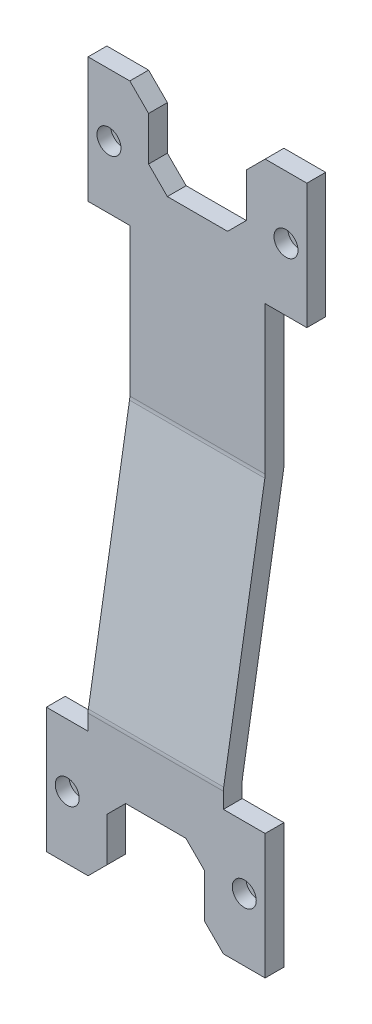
SolidWorks part; units mm, degrees
ref_plane "Alzado" through (0, 0, 0) normal (0, 0, 1) x (1, 0, 0)
ref_plane "Planta" through (0, 0, 0) normal (0, 1, 0) x (1, 0, 0)
ref_plane "Vista lateral" through (0, 0, 0) normal (1, 0, 0) x (0, 0, -1)
sketch "Croquis1" plane through (0, 0, 0) normal (0, 0, 1) x (1, 0, 0)
  line L18 (-16.2157, -79.99) -> (-16.2157, -64.99) construction
  line L19 (16.2157, -49.99) -> (16.2157, -64.99) construction
  line L20 (-16.2157, 49.99) -> (-16.2157, -49.99)
  line L21 (16.2157, -49.99) -> (16.2157, 49.99)
  line L22 (-7.2157, -60.49) -> (7.2157, -60.49)
  line L23 (16.2157, 79.99) -> (11.7157, 75.49)
  line L24 (11.7157, 75.49) -> (11.7157, 64.99)
  line L25 (11.7157, 64.99) -> (7.2157, 60.49)
  line L26 (-16.2157, 79.99) -> (-11.7157, 75.49)
  line L27 (-11.7157, 75.49) -> (-11.7157, 64.99)
  line L28 (-11.7157, 64.99) -> (-7.2157, 60.49)
  line L29 (-7.2157, 60.49) -> (7.2157, 60.49)
  line L34 (16.2157, -64.99) -> (16.2157, -79.99) construction
  line L35 (16.2157, -79.99) -> (26.2157, -79.99)
  line L36 (26.2157, -79.99) -> (26.2157, -49.99)
  line L37 (26.2157, -49.99) -> (16.2157, -49.99)
  line L38 (-26.2157, -49.99) -> (-26.2157, -79.99)
  line L39 (-26.2157, -79.99) -> (-16.2157, -79.99)
  line L40 (-16.2157, -64.99) -> (-16.2157, -49.99) construction
  line L41 (-16.2157, -49.99) -> (-26.2157, -49.99)
  line L42 (16.2157, 79.99) -> (16.2157, 49.99) construction
  line L43 (16.2157, 49.99) -> (26.2157, 49.99)
  line L44 (26.2157, 49.99) -> (26.2157, 79.99)
  line L45 (26.2157, 79.99) -> (16.2157, 79.99)
  line L46 (-26.2157, 79.99) -> (-26.2157, 49.99)
  line L47 (-26.2157, 49.99) -> (-16.2157, 49.99)
  line L48 (-16.2157, 49.99) -> (-16.2157, 79.99) construction
  line L49 (-16.2157, 79.99) -> (-26.2157, 79.99)
  line L50 (-16.2157, -79.99) -> (-11.7157, -75.49)
  line L51 (-11.7157, -75.49) -> (-11.7157, -64.99)
  line L52 (-11.7157, -64.99) -> (-7.2157, -60.49)
  line L53 (-16.2157, -64.99) -> (16.2157, -64.99) construction
  line L54 (0, 111.3599) -> (0, -111.3599) construction
  line L55 (16.2157, -79.99) -> (11.7157, -75.49)
  line L56 (11.7157, -75.49) -> (11.7157, -64.99)
  line L57 (11.7157, -64.99) -> (7.2157, -60.49)
  line L58 (-16.2157, 49.99) -> (-16.2157, -49.99) construction
  line L59 (-16.2157, 0) -> (0, 0) construction
  point P24 (0, -64.99)
  point P41 (0, 0)
  point P44 (0, 0)
  dimension "D1" = 10
  dimension "D2" = 30
  dimension "D3" = 4.5
  dimension "D4" = 10
  dimension "D5" = 45
  dimension "D6" = 23.4313
  dimension "D7" = 15
  dimension "D8" = 19.5
  dimension "D9" = 99.98
extrude "Saliente-Extruir1" add sketch "Croquis1" against normal blind 5
sketch "Croquis2" plane through (0, 0, -5) normal (0, 0, -1) x (-1, 0, 0)
  line L19 (-16.2157, -49.99) -> (16.2157, -49.99)
  line L50 (-16.2157, -49.99) -> (-26.2157, -49.99)
  line L51 (-26.2157, -49.99) -> (-26.2157, -79.99)
  line L52 (-26.2157, -79.99) -> (-16.2157, -79.99)
  line L53 (-16.2157, -79.99) -> (-11.7157, -75.49)
  line L54 (-11.7157, -75.49) -> (-11.7157, -64.99)
  line L55 (-11.7157, -64.99) -> (-7.2157, -60.49)
  line L56 (-7.2157, -60.49) -> (7.2157, -60.49)
  line L57 (7.2157, -60.49) -> (11.7157, -64.99)
  line L58 (11.7157, -64.99) -> (11.7157, -75.49)
  line L59 (11.7157, -75.49) -> (16.2157, -79.99)
  line L60 (16.2157, -79.99) -> (26.2157, -79.99)
  line L61 (26.2157, -79.99) -> (26.2157, -49.99)
  line L62 (26.2157, -49.99) -> (16.2157, -49.99)
  line L63 (16.2157, -49.99) -> (16.2157, 49.99)
  line L64 (16.2157, 49.99) -> (26.2157, 49.99)
  line L65 (26.2157, 49.99) -> (26.2157, 79.99)
  line L66 (26.2157, 79.99) -> (16.2157, 79.99)
  line L67 (16.2157, 79.99) -> (11.7157, 75.49)
  line L68 (11.7157, 75.49) -> (11.7157, 64.99)
  line L69 (11.7157, 64.99) -> (7.2157, 60.49)
  line L70 (7.2157, 60.49) -> (-7.2157, 60.49)
  line L71 (-7.2157, 60.49) -> (-11.7157, 64.99)
  line L72 (-11.7157, 64.99) -> (-11.7157, 75.49)
  line L73 (-11.7157, 75.49) -> (-16.2157, 79.99)
  line L74 (-16.2157, 79.99) -> (-26.2157, 79.99)
  line L75 (-26.2157, 79.99) -> (-26.2157, 49.99)
  line L76 (-26.2157, 49.99) -> (-16.2157, 49.99)
  line L77 (-16.2157, 49.99) -> (-16.2157, -49.99)
  line L78 (-16.2157, -49.99) -> (-26.2157, -49.99) construction
  line L79 (-26.2157, -49.99) -> (-26.2157, -79.99) construction
  line L80 (-26.2157, -79.99) -> (-16.2157, -79.99) construction
  line L81 (-16.2157, -79.99) -> (-11.7157, -75.49) construction
  line L82 (-11.7157, -75.49) -> (-11.7157, -64.99) construction
  line L83 (-11.7157, -64.99) -> (-7.2157, -60.49) construction
  line L84 (-7.2157, -60.49) -> (7.2157, -60.49) construction
  line L85 (7.2157, -60.49) -> (11.7157, -64.99) construction
  line L86 (11.7157, -64.99) -> (11.7157, -75.49) construction
  line L87 (11.7157, -75.49) -> (16.2157, -79.99) construction
  line L88 (16.2157, -79.99) -> (26.2157, -79.99) construction
  line L89 (26.2157, -79.99) -> (26.2157, -49.99) construction
  line L90 (26.2157, -49.99) -> (16.2157, -49.99) construction
  line L91 (16.2157, -49.99) -> (16.2157, 49.99)
  line L92 (16.2157, 49.99) -> (26.2157, 49.99)
  line L93 (26.2157, 49.99) -> (26.2157, 79.99)
  line L94 (26.2157, 79.99) -> (16.2157, 79.99)
  line L95 (16.2157, 79.99) -> (11.7157, 75.49)
  line L96 (11.7157, 75.49) -> (11.7157, 64.99)
  line L97 (11.7157, 64.99) -> (7.2157, 60.49)
  line L98 (7.2157, 60.49) -> (-7.2157, 60.49)
  line L99 (-7.2157, 60.49) -> (-11.7157, 64.99)
  line L100 (-11.7157, 64.99) -> (-11.7157, 75.49)
  line L101 (-11.7157, 75.49) -> (-16.2157, 79.99)
  line L102 (-16.2157, 79.99) -> (-26.2157, 79.99)
  line L103 (-26.2157, 79.99) -> (-26.2157, 49.99)
  line L104 (-26.2157, 49.99) -> (-16.2157, 49.99)
  line L105 (-16.2157, 49.99) -> (-16.2157, -49.99)
  dimension "D1" = 0
extrude "Saliente-Extruir2" add sketch "Croquis2" along normal blind 10
sketch "Croquis3" plane through (26.2157, 0, 0) normal (1, 0, 0) x (0, 0, -1)
  line L1 (0, -46.2324) -> (0, 79.99)
  line L6 (0, -49.99) -> (0, 49.99) construction
  line L7 (0, 79.99) -> (10, 79.9949)
  line L10 (10, 79.9949) -> (10, 14.5952)
  line L11 (9.932, 13.7732) -> (0.068, -45.4104)
  arc A3 (10, 14.5952) -> (9.932, 13.7732) centre (5, 14.5952) cw
  arc A4 (0.068, -45.4104) -> (0, -46.2324) centre (5, -46.2324) ccw
extrude "Cortar-Extruir1" cut sketch "Croquis3" against normal through all
sketch "Croquis4" plane through (26.2157, 0, 0) normal (1, 0, 0) x (0, 0, -1)
  line L16 (15.2623, 15.3413) -> (15, -49.99)
  line L17 (5, -46.2324) -> (14.8639, 12.9512)
  line L18 (5, -46.2324) -> (15.2623, 15.3413)
  line L22 (5, -46.2324) -> (5, -49.99)
  line L23 (5, -49.99) -> (15, -49.99)
  line L24 (15, 49.99) -> (15, -49.99) construction
  dimension "D1" = 5
extrude "Cortar-Extruir2" cut sketch "Croquis4" against normal through all
fillet "Redondeo1" radius 5 2 edges at (0, -46.2324, -5) (0, 13.7676, -15)
sketch "Croquis5" plane through (0, 0, 0) normal (0, 0, 1) x (1, 0, 0)
  line L0 (21.2157, 79.99) -> (21.2157, 49.99) construction
  line L1 (26.2157, 79.99) -> (16.2157, 79.99) construction
  line L2 (16.2157, 49.99) -> (26.2157, 49.99) construction
  line L3 (21.2157, 49.99) -> (-21.2157, 79.99) construction
  line L4 (-16.2157, 79.99) -> (-26.2157, 79.99) construction
  line L5 (-21.2157, 79.99) -> (-21.2157, 49.99) construction
  line L6 (-26.2157, 49.99) -> (-16.2157, 49.99) construction
  line L7 (21.2157, -79.99) -> (21.2157, -49.99) construction
  line L8 (16.2157, -79.99) -> (26.2157, -79.99) construction
  line L9 (26.2157, -49.99) -> (16.2157, -49.99) construction
  line L10 (21.2157, -49.99) -> (-21.2157, -79.99) construction
  line L11 (-26.2157, -79.99) -> (-16.2157, -79.99) construction
  line L12 (-21.2157, -79.99) -> (-21.2157, -49.99) construction
  line L13 (-16.2157, -49.99) -> (-26.2157, -49.99) construction
  circle A0 centre (-21.2157, -64.99) radius 1.55
  circle A1 centre (21.2157, -64.99) radius 1.55
  circle A2 centre (21.2157, 64.99) radius 1.55
  circle A3 centre (-21.2157, 64.99) radius 1.55
  dimension "D1" = 3.1
extrude "Cortar-Extruir3" cut sketch "Croquis5" against normal through all
sketch "Croquis6" plane through (0, 0, 0) normal (0, 0, 1) x (1, 0, 0)
  circle A0 centre (21.2157, -64.99) radius 2.875
  circle A1 centre (-21.2157, -64.99) radius 2.875
  circle A2 centre (-21.2157, 64.99) radius 2.875
  circle A3 centre (21.2157, 64.99) radius 2.875
  dimension "D1" = 5.75
extrude "Cortar-Extruir4" cut sketch "Croquis6" against normal blind 3.3
sketch "Croquis7" plane through (0, 0, -10) normal (0, 0, 1) x (1, 0, 0)
  circle A0 centre (-21.2157, 64.99) radius 2.875
  circle A1 centre (21.2157, 64.99) radius 2.875
  dimension "D1" = 5.75
extrude "Cortar-Extruir5" cut sketch "Croquis7" against normal blind 3.3
sketch "Croquis8" plane through (26.2157, 0, 0) normal (1, 0, 0) x (0, 0, -1)
  line L0 (15, 79.99) -> (15, 49.99) construction
  line L1 (15, 49.99) -> (15, 14.1814) construction
  line L2 (14.932, 13.3594) -> (5.068, -45.8243) construction
  line L3 (5, -46.6463) -> (5, -49.99) construction
  line L4 (5, -79.99) -> (5, -49.99) construction
  line L5 (15, 79.99) -> (15, 49.99)
  line L6 (15, 49.99) -> (15, 14.1814)
  line L7 (14.932, 13.3594) -> (5.068, -45.8243)
  line L8 (5, -46.6463) -> (5, -49.99)
  line L9 (5, -79.99) -> (5, -49.99)
  line L10 (14.5, 79.99) -> (14.5, 49.99)
  line L11 (14.5, 49.99) -> (14.5, 14.1814)
  line L12 (14.4388, 13.4416) -> (4.5748, -45.7421)
  line L13 (4.5, -46.6463) -> (4.5, -49.99)
  line L14 (4.5, -79.99) -> (4.5, -49.99)
  line L15 (4.5, -79.99) -> (5, -79.99)
  line L16 (15, 79.99) -> (14.5, 79.99)
  arc A0 (14.932, 13.3594) -> (15, 14.1814) centre (10, 14.1814) ccw construction
  arc A1 (5.068, -45.8243) -> (5, -46.6463) centre (10, -46.6463) ccw construction
  arc A2 (14.932, 13.3594) -> (15, 14.1814) centre (10, 14.1814) ccw
  arc A3 (5.068, -45.8243) -> (5, -46.6463) centre (10, -46.6463) ccw
  arc A4 (14.4388, 13.4416) -> (14.5, 14.1814) centre (10, 14.1814) ccw
  arc A5 (4.5748, -45.7421) -> (4.5, -46.6463) centre (10, -46.6463) ccw
  dimension "D1" = 0.5
extrude "Cortar-Extruir6" cut sketch "Croquis8" against normal through all
